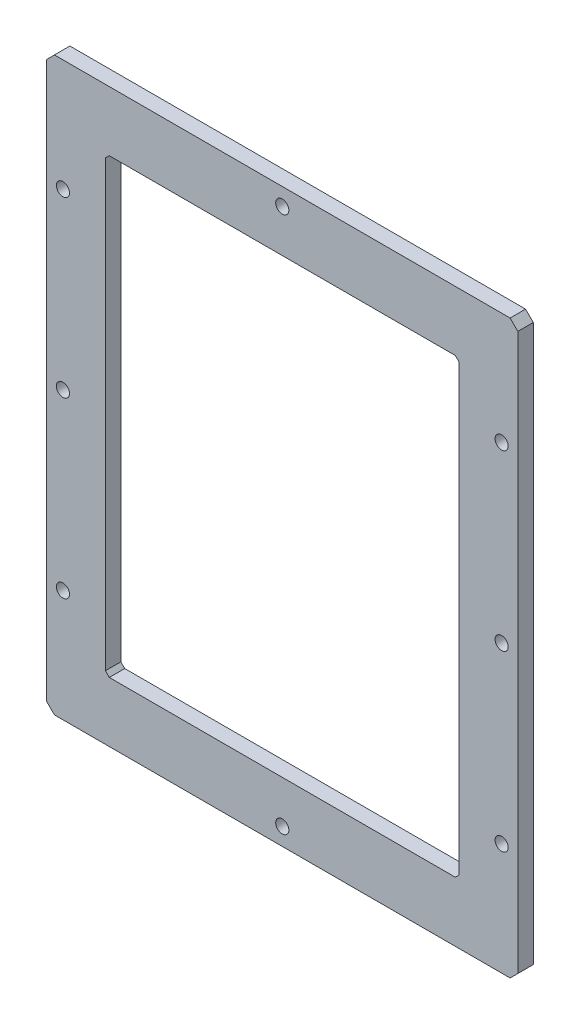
SolidWorks part; units mm, degrees
ref_plane "前视基准面" through (0, 0, 0) normal (0, 0, 1) x (1, 0, 0)
ref_plane "上视基准面" through (0, 0, 0) normal (0, 1, 0) x (1, 0, 0)
ref_plane "右视基准面" through (0, 0, 0) normal (1, 0, 0) x (0, 0, -1)
other "Configuration Table"
sketch "草图1" plane through (0, 0, 0) normal (0, 0, 1) x (1, 0, 0)
  line L0 (-59, -74) -> (59, -74)
  line L1 (59, -74) -> (61, -72)
  line L2 (61, -72) -> (61, 72)
  line L3 (61, 72) -> (59, 74)
  line L4 (59, 74) -> (-59, 74)
  line L5 (-59, 74) -> (-61, 72)
  line L6 (-61, 72) -> (-61, -72)
  line L7 (-61, -72) -> (-59, -74)
  line L8 (-44.8, -58.5) -> (44.8, -58.5)
  line L9 (44.8, -58.5) -> (45.8, -57.5)
  line L10 (45.8, -57.5) -> (45.8, 57.5)
  line L11 (45.8, 57.5) -> (44.8, 58.5)
  line L12 (44.8, 58.5) -> (-44.8, 58.5)
  line L13 (-44.8, 58.5) -> (-45.8, 57.5)
  line L14 (-45.8, 57.5) -> (-45.8, -57.5)
  line L15 (-45.8, -57.5) -> (-44.8, -58.5)
  circle A0 centre (-56.8, -45) radius 1.7
  circle A1 centre (-56.8, 0) radius 1.7
  circle A2 centre (-56.8, 45) radius 1.7
  circle A3 centre (56.8, -45) radius 1.7
  circle A4 centre (56.8, 0) radius 1.7
  circle A5 centre (56.8, 45) radius 1.7
  circle A6 centre (0, -69.5) radius 1.7
  circle A7 centre (0, 69.5) radius 1.7
  dimension "D1" = 3.4
  dimension "D2" = 44.8
  dimension "D3" = 45.8
  dimension "D4" = 56.8
  dimension "D5" = 59
  dimension "D6" = 61
  dimension "D7" = 44.8
  dimension "D8" = 56.8
  dimension "D9" = 59
  dimension "D10" = 45
  dimension "D11" = 57.5
  dimension "D12" = 58.5
  dimension "D13" = 69.5
  dimension "D14" = 72
  dimension "D15" = 74
  dimension "D16" = 45
  dimension "D17" = 57.5
  dimension "D18" = 69.5
  dimension "D19" = 72
extrude "Flat_ring_8_clearance_holes_outside_film" add sketch "草图1" along normal blind 4
